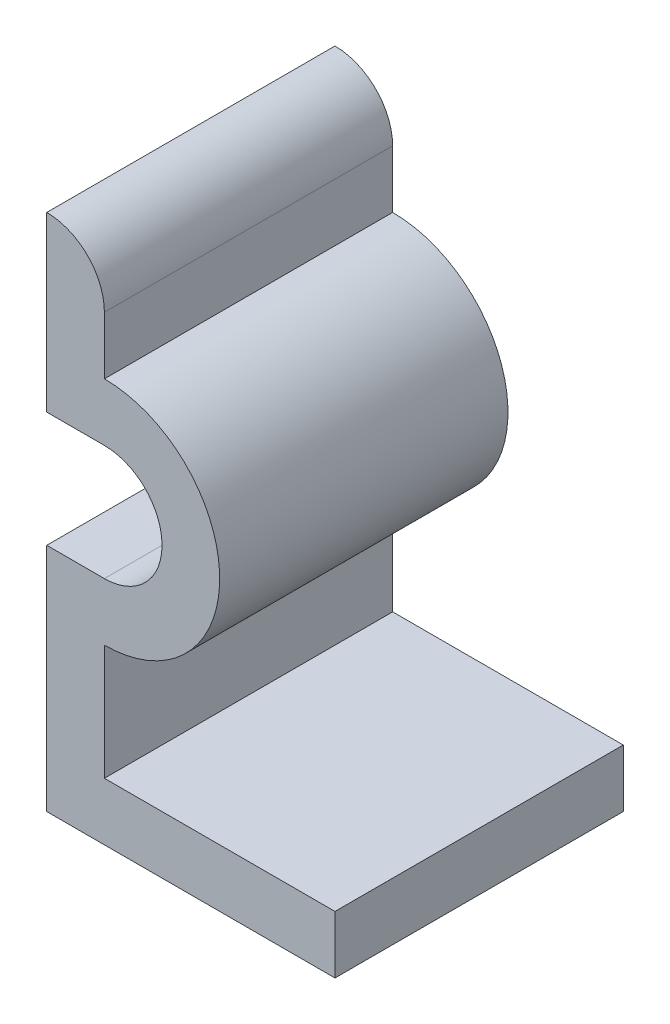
SolidWorks part; units mm, degrees
ref_plane "Front Plane" through (0, 0, 0) normal (0, 0, 1) x (1, 0, 0)
ref_plane "Top Plane" through (0, 0, 0) normal (0, 1, 0) x (1, 0, 0)
ref_plane "Right Plane" through (0, 0, 0) normal (1, 0, 0) x (0, 0, -1)
sketch "Sketch1" plane through (0, 0, 0) normal (0, 0, 1) x (1, 0, 0)
  line L0 (0, 0) -> (25, 0)
  line L1 (25, 0) -> (25, 5)
  line L2 (25, 5) -> (5, 5)
  line L3 (5, 5) -> (5, 15)
  line L4 (5, 35) -> (5, 40)
  line L6 (0, 45) -> (0, 30)
  line L7 (0, 20) -> (5, 20)
  line L8 (0, 20) -> (0, 0)
  line L9 (0, 30) -> (5, 30)
  arc A0 (5, 35) -> (5, 15) centre (5, 25) cw
  arc A1 (5, 20) -> (5, 30) centre (5, 25) ccw
  arc A2 (5, 40) -> (0, 45) centre (0, 40) ccw
  dimension "D4" = 10
  dimension "D7" = 5
  dimension "D8" = 15
  dimension "D1" = 5
  dimension "D2" = 20
  dimension "D3" = 25
  dimension "D5" = 5
extrude "Extrude1" add sketch "Sketch1" along normal mid plane 25
